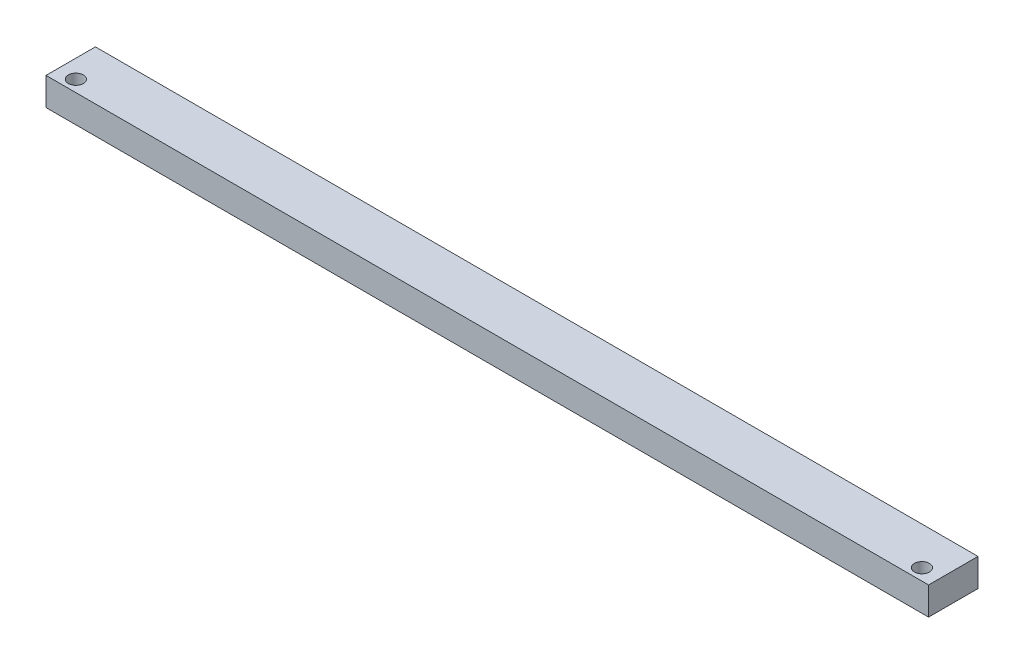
SolidWorks part; units mm, degrees
ref_plane "Front Plane" through (0, 0, 0) normal (0, 0, 1) x (1, 0, 0)
ref_plane "Top Plane" through (0, 0, 0) normal (0, 1, 0) x (1, 0, 0)
ref_plane "Right Plane" through (0, 0, 0) normal (1, 0, 0) x (0, 0, -1)
sketch "Sketch1" plane through (0, 0, 0) normal (0, 1, 0) x (1, 0, 0)
  line L0 (17.0509, 11.5366) -> (17.0509, 4.5135) construction
  line L1 (-45.6363, 11.5366) -> (79.7381, 11.5366)
  line L2 (-45.6363, 11.5366) -> (-45.6363, 4.5135)
  line L3 (-45.6363, 4.5135) -> (79.7381, 4.5135)
  line L4 (79.7381, 11.5366) -> (79.7381, 4.5135)
  circle A0 centre (77.1473, 6.1645) radius 1.0668
  circle A1 centre (-43.0455, 6.1645) radius 1.0668
  dimension "D3" = 2.5908
  dimension "D1" = 125.3744
  dimension "D2" = 7.0231
  dimension "D4" = 1.651
extrude "Boss-Extrude1" add sketch "Sketch1" along normal blind 3.9624
